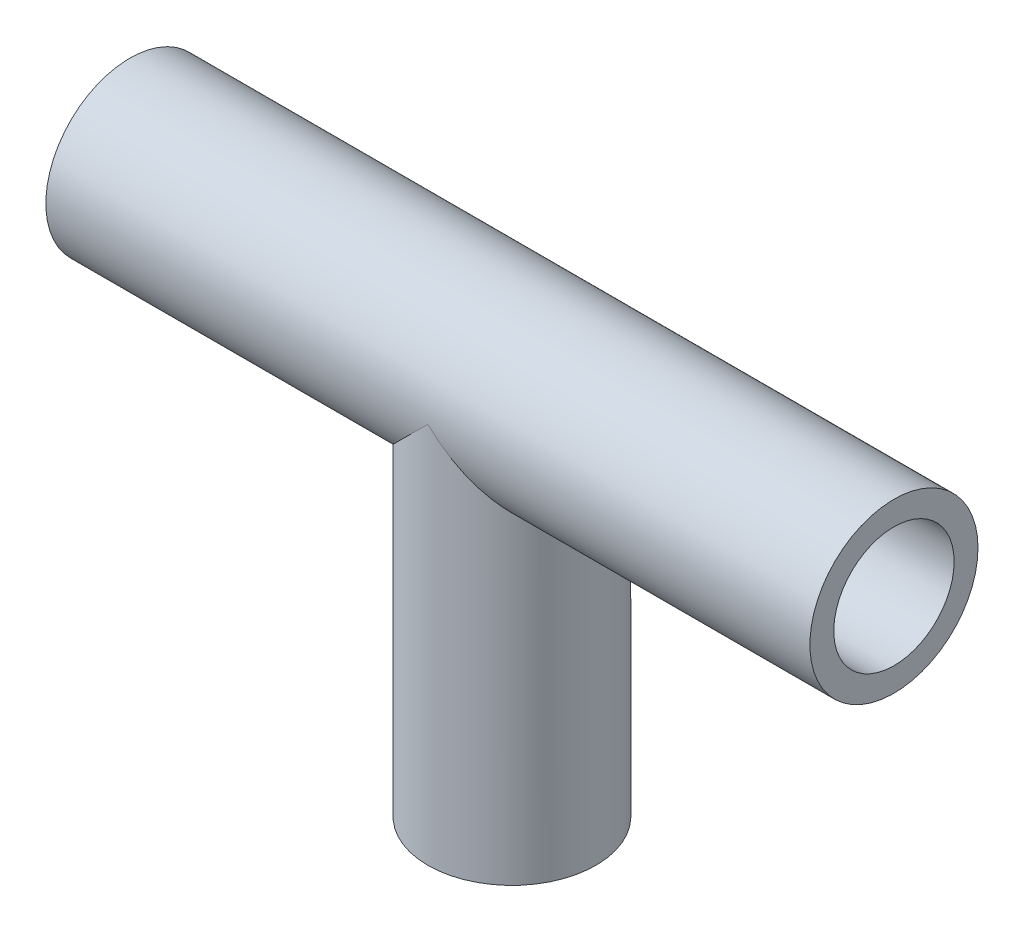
SolidWorks part; units mm, degrees
ref_plane "Front Plane" through (0, 0, 0) normal (0, 0, 1) x (1, 0, 0)
ref_plane "Top Plane" through (0, 0, 0) normal (0, 1, 0) x (1, 0, 0)
ref_plane "Right Plane" through (0, 0, 0) normal (1, 0, 0) x (0, 0, -1)
sketch "Sketch2" plane through (0, 0, 0) normal (0, 1, 0) x (0, 0, -1)
  line L0 (0, 0) -> (0, 27.3455) construction
  line L1 (-5.588, 25.4) -> (-4.0005, 25.4)
  line L2 (-5.588, 25.4) -> (-5.588, -25.4)
  line L3 (-5.588, -25.4) -> (-4.0005, -25.4)
  line L4 (-4.0005, 25.4) -> (-4.0005, -25.4)
  line L5 (0, 0) -> (-4.0005, 0) construction
  dimension "D1" = 50.8
  dimension "D2" = 5.588
  dimension "D3" = 1.5875
ref_plane "Plane1" through (0, -25.4, 0) normal (0, 1, 0) x (1, 0, 0)
revolve "Revolve1" add sketch "Sketch2" angle 360 about L0
sketch "Sketch4" plane through (0, -25.4, 0) normal (0, 1, 0) x (1, 0, 0)
  line L0 (-25.4, -5.588) -> (25.4, -5.588) construction
  circle A0 centre (0, 0) radius 5.588
  circle A1 centre (0, 0) radius 4.0005
  dimension "D1" = 1.5875
extrude "Boss-Extrude2" add sketch "Sketch4" along normal up to body separate body
